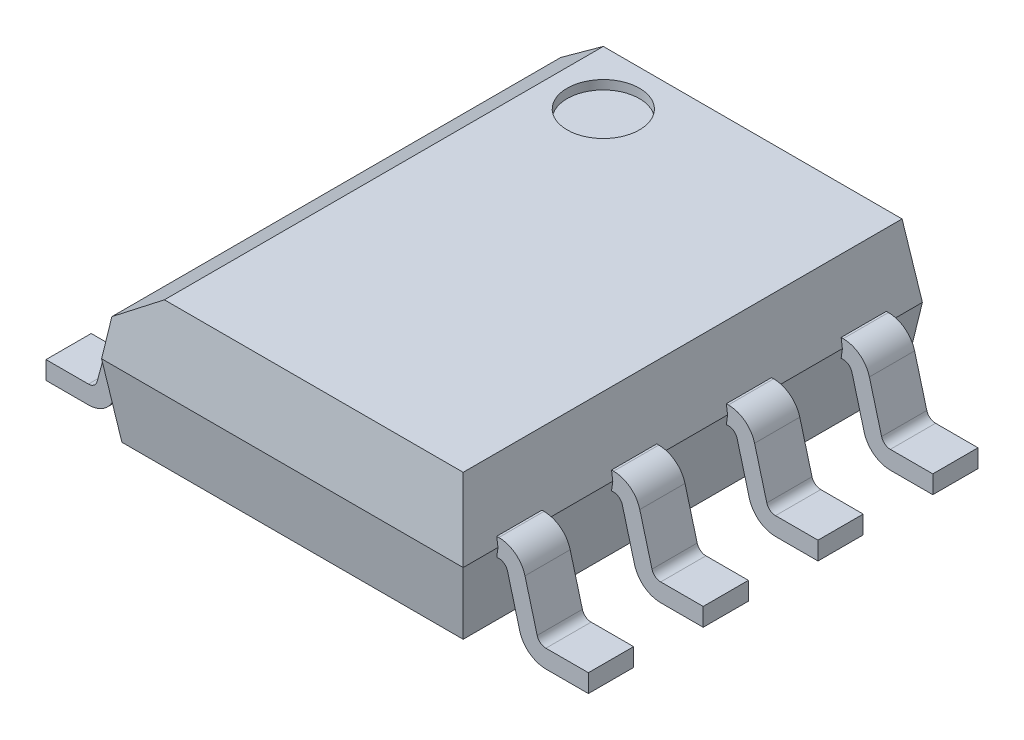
SolidWorks part; units mm, degrees
ref_plane "Front" through (0, 0, 0) normal (0, 0, 1) x (1, 0, 0)
ref_plane "Top" through (0, 0, 0) normal (0, 1, 0) x (1, 0, 0)
ref_plane "Right" through (0, 0, 0) normal (1, 0, 0) x (0, 0, -1)
ref_plane "ПлоскостьВывод1" through (0, 0, -1.905) normal (0, 0, 1) x (1, 0, 0)
sketch "ЭскизВывод1" plane through (0, 0, -1.905) normal (0, 0, 1) x (1, 0, 0)
  line L0 (-3, 0) -> (-2.5302, 0)
  line L1 (-2.2404, 0.2224) -> (-2.1055, 0.7259)
  line L2 (-2.0089, 0.8) -> (2.0089, 0.8)
  line L3 (0, 0.8) -> (0, 0) construction
  line L4 (2.2404, 0.2224) -> (2.1055, 0.7259)
  line L5 (3, 0) -> (2.5302, 0)
  arc A0 (-2.1055, 0.7259) -> (-2.0089, 0.8) centre (-2.0089, 0.7) cw
  arc A1 (-2.5302, 0) -> (-2.2404, 0.2224) centre (-2.5302, 0.3) ccw
  arc A2 (2.5302, 0) -> (2.2404, 0.2224) centre (2.5302, 0.3) cw
  arc A3 (2.1055, 0.7259) -> (2.0089, 0.8) centre (2.0089, 0.7) ccw
  point P8 (-2.0856, 0.8)
  point P11 (-2.3, 0)
  dimension "D6" = 0.1
  dimension "D7" = 0.3
  dimension "H" = 6
  dimension "A2" = 0.8
  dimension "L" = 0.7
  dimension "D4" = 75
  dimension "D5" = 4.1713
extrude "Вывод1" add sketch "ЭскизВывод1" along normal mid plane 0.5 thin
ref_plane "ПлоскостьКорпус" through (0, 0.9, 0) normal (0, 1, 0) x (-1, 0, 0)
sketch "ЭскизКорпус" plane through (0, 0.9, 0) normal (0, 1, 0) x (1, 0, 0)
  line L1 (2, -2.54) -> (-2, -2.54)
  line L2 (2, -2.54) -> (2, 2.54)
  line L3 (2, 2.54) -> (-2, 2.54)
  line L4 (-2, -2.54) -> (-2, 2.54)
  line L5 (2, -2.54) -> (-2, 2.54) construction
  line L6 (2, 2.54) -> (-2, -2.54) construction
  point P0 (0, 0)
  dimension "D" = 5.08
  dimension "E" = 4
extrude "Корпус" add sketch "ЭскизКорпус" along normal mid plane 1.6 draft 8
pattern_linear "Выводы" count 4 spacing 1.27 along (0, 0, 1) of "Вывод1"
chamfer "Фаска1" distance 0.4 angle 45 1 edges at (-1.8876, 1.7, 0)
sketch "Эскиз3" plane through (0, 1.7, 0) normal (0, 1, 0) x (1, 0, 0)
  line L0 (-1.4176, 1.8276) -> (-0.8176, 1.8276) construction
  line L1 (-1.4176, 2.4276) -> (-1.4176, -2.4276) construction
  line L2 (-0.8176, 1.8276) -> (-0.8176, 2.4276) construction
  line L3 (1.8876, 2.4276) -> (-1.4176, 2.4276) construction
  circle A0 centre (-0.8176, 1.8276) radius 0.4
  dimension "D2" = 0.8
  dimension "D1" = 0.6
extrude "Вытянуть3" cut sketch "Эскиз3" against normal blind 0.1
